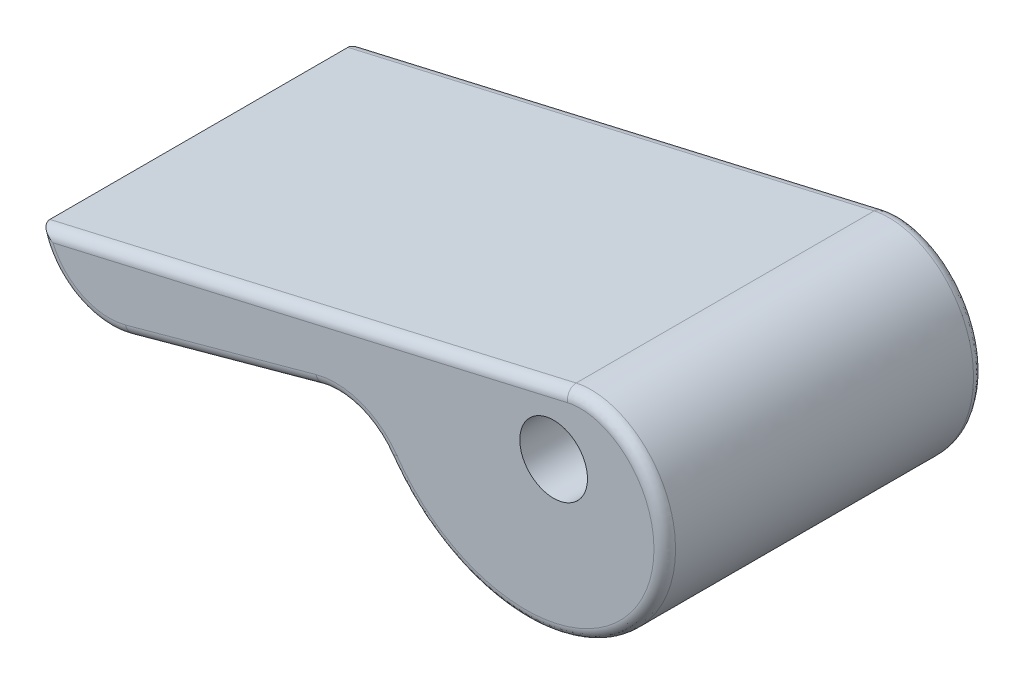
SolidWorks part; units mm, degrees
ref_plane "Front" through (0, 0, 0) normal (0, 0, 1) x (1, 0, 0)
ref_plane "Top" through (0, 0, 0) normal (0, 1, 0) x (1, 0, 0)
ref_plane "Right" through (0, 0, 0) normal (1, 0, 0) x (0, 0, -1)
sketch "Sketch1" plane through (0, 0, 0) normal (0, 0, 1) x (1, 0, 0)
  circle A3 centre (0, 0) radius 4.7625
  dimension "D1" = 9.525
curve "Helix1"
sketch "Sketch2" plane through (0, 0, 0) normal (0, 0, 1) x (1, 0, 0)
  line L0 (0.827, 4.6901) -> (-36.2969, -3.8785)
  line L1 (-16.5639, -3.9449) -> (-30.002, -7.6347)
  arc A0 (-11.7001, -5.7065) -> (-16.5639, -3.9449) centre (-15.3777, -8.265) ccw
  arc A1 (-30.002, -7.6347) -> (-36.2969, -3.8785) centre (-31.3471, -2.7361) cw
  spline S1 degree 3 poles (0.827, 4.6901) (1.2559, 4.7891) (1.7195, 4.8292) (2.6793, 4.7676) (3.1755, 4.6659) (4.1567, 4.3084) (4.6416, 4.0525) (5.5525, 3.3879) (5.9784, 2.9792) (6.7241, 2.0245) (7.0439, 1.4785) (7.5349, 0.2793) (7.7061, -0.374) (7.8666, -1.7454) (7.8558, -2.4634) (7.6314, -3.9121) (7.4177, -4.6425) (6.782, -6.0577) (6.3599, -6.7423) (5.3186, -8.0056) (4.6994, -8.5842) (3.2926, -9.579) (2.5049, -9.9951) (0.8057, -10.6164) (-0.1057, -10.8215) (-1.9941, -10.9852) (-2.9709, -10.9437) (-4.9219, -10.5951) (-5.8958, -10.2879) (-7.7677, -9.408) (-8.6654, -8.8352) (-10.3116, -7.4445) (-11.0599, -6.6266) (-11.7001, -5.7065) knots 0 0 0 0 0.0625 0.0625 0.125 0.125 0.1875 0.1875 0.25 0.25 0.3125 0.3125 0.375 0.375 0.4375 0.4375 0.5 0.5 0.5625 0.5625 0.625 0.625 0.6875 0.6875 0.75 0.75 0.8125 0.8125 0.875 0.875 0.9375 0.9375 1 1 1 1
  spline S2 degree 3 poles (0.827, 4.6901) (1.2559, 4.7891) (1.7195, 4.8292) (2.6793, 4.7676) (3.1755, 4.6659) (4.1567, 4.3084) (4.6416, 4.0525) (5.5525, 3.3879) (5.9784, 2.9792) (6.7241, 2.0245) (7.0439, 1.4785) (7.5349, 0.2793) (7.7061, -0.374) (7.8666, -1.7454) (7.8558, -2.4634) (7.6314, -3.9121) (7.4177, -4.6425) (6.782, -6.0577) (6.3599, -6.7423) (5.3186, -8.0056) (4.6994, -8.5842) (3.2926, -9.579) (2.5049, -9.9951) (0.8057, -10.6164) (-0.1057, -10.8215) (-1.9941, -10.9852) (-2.9709, -10.9437) (-4.9219, -10.5951) (-5.8958, -10.2879) (-7.7677, -9.408) (-8.6654, -8.8352) (-10.3116, -7.4445) (-11.0599, -6.6266) (-11.7001, -5.7065) knots 0 0 0 0 0.0625 0.0625 0.125 0.125 0.1875 0.1875 0.25 0.25 0.3125 0.3125 0.375 0.375 0.4375 0.4375 0.5 0.5 0.5625 0.5625 0.625 0.625 0.6875 0.6875 0.75 0.75 0.8125 0.8125 0.875 0.875 0.9375 0.9375 1 1 1 1
  dimension "D3" = 5.08
  dimension "D2" = 38.1
  dimension "D1" = 0
extrude "Extrude1" add sketch "Sketch2" along normal mid plane 22.5425
sketch "Sketch3" plane through (0, 0, 11.2712) normal (0, 0, 1) x (1, 0, 0)
  circle A0 centre (0, 0) radius 2.3876
  dimension "D1" = 4.7752
extrude "Cut-Extrude1" cut sketch "Sketch3" against normal through all
fillet "Fillet2" radius 0.762 10 edges at (-13.852, -4.0527, -11.2712) (-23.2829, -5.7898, -11.2712) (-13.852, -4.0527, 11.2712) (-23.2829, -5.7898, 11.2712) (-17.735, 0.4058, -11.2712) (-17.735, 0.4058, 11.2712) (-33.9501, -7.0985, -11.2712) (-33.9501, -7.0985, 11.2712)
